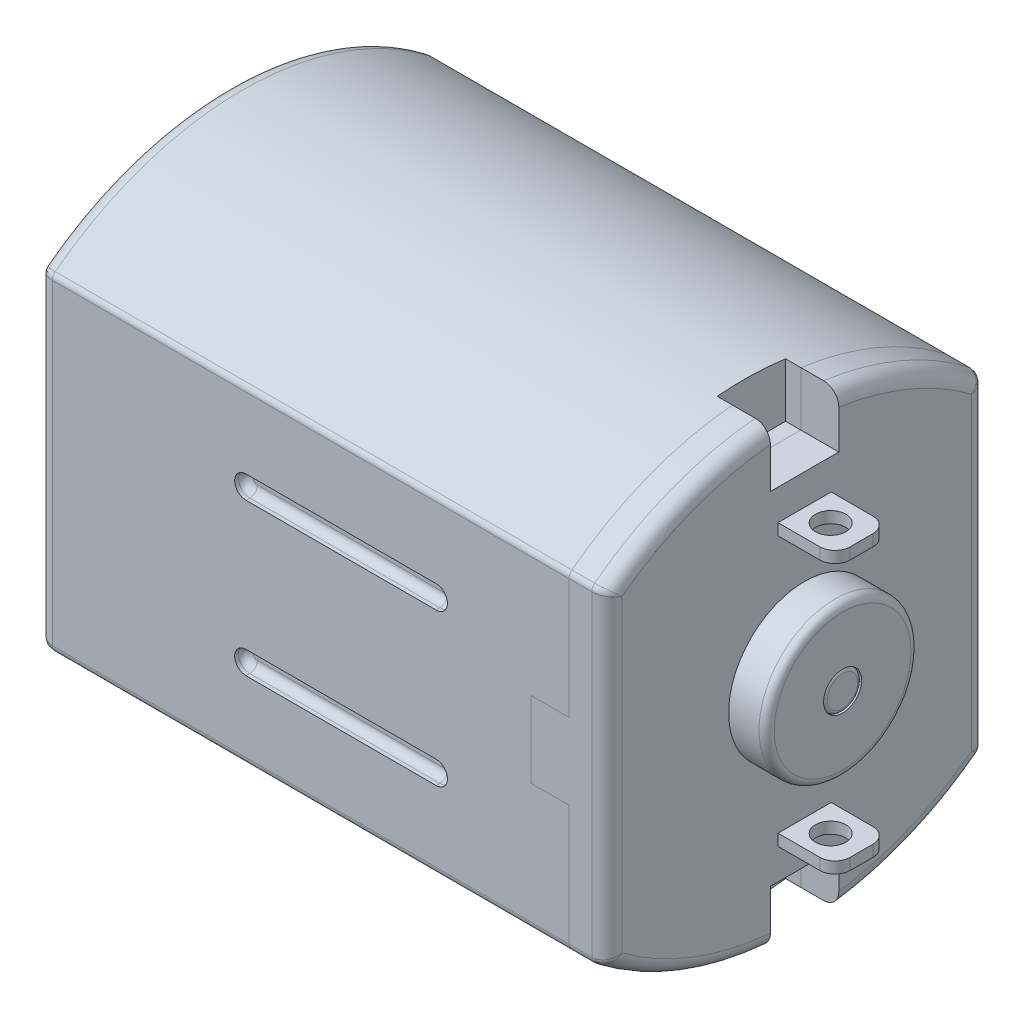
SolidWorks part; units mm, degrees
ref_plane "前视基准面" through (0, 0, 0) normal (0, 0, 1) x (1, 0, 0)
ref_plane "上视基准面" through (0, 0, 0) normal (0, 1, 0) x (1, 0, 0)
ref_plane "右视基准面" through (0, 0, 0) normal (1, 0, 0) x (0, 0, -1)
sketch "草图5" plane through (0, 0, 0) normal (0, 0, 1) x (1, 0, 0)
  line L0 (0, 0) -> (55.3713, 0) construction
  line L1 (0, -6) -> (0, 6)
  line L2 (0, 6) -> (14, 6)
  line L3 (14, 6) -> (14, 1)
  line L4 (14, 1) -> (13, 1)
  line L5 (13, 1) -> (13, -1)
  line L6 (14, -1) -> (13, -1)
  line L7 (14, -6) -> (14, -1)
  line L8 (0, -6) -> (14, -6)
  point P9 (13, 0)
  dimension "D1" = 6
  dimension "D2" = 14
  dimension "D3" = 1
  dimension "D4" = 1
extrude "凸台-拉伸3" add sketch "草图5" along normal blind 10
sketch "草图6" plane through (0, 0, 0) normal (0, 0, 1) x (1, 0, 0)
  line L0 (14, 6) -> (15, 6)
  line L1 (14, 1) -> (14, 6) construction
  line L2 (13, 1) -> (14, 1) construction
  line L3 (13, -1) -> (13, 1) construction
  line L4 (14, -1) -> (13, -1) construction
  line L5 (14, -6) -> (14, -1) construction
  line L6 (14, 1) -> (14, 6)
  line L7 (13, 1) -> (14, 1)
  line L8 (13, -1) -> (13, 1)
  line L9 (14, -1) -> (13, -1)
  line L10 (14, -6) -> (14, -1)
  line L11 (14, -6) -> (15, -6)
  line L12 (15, -6) -> (15, 6)
  dimension "D1" = 1
extrude "凸台-拉伸4" add sketch "草图6" along normal blind 10 separate body
sketch "草图7" plane through (0, 0, 0) normal (-1, 0, 0) x (0, 0, 1)
  line L0 (0, 6) -> (0, -6) construction
  circle A0 centre (5, 0) radius 1
  dimension "D2" = 2
  dimension "D1" = 5
extrude "凸台-拉伸5" add sketch "草图7" along normal blind 3
sketch "草图8" plane through (0, 0, 0) normal (-1, 0, 0) x (0, 0, 1)
  line L0 (10, 6) -> (10, 4.2617)
  line L1 (10, 6) -> (0, 6) construction
  line L2 (0, 0) -> (10, 0) construction
  line L3 (10, -6) -> (0, -6) construction
  line L4 (5, 6) -> (5, 0) construction
  line L5 (10, 6) -> (0, 6)
  line L6 (0, 6) -> (0, -6) construction
  line L7 (10, -6) -> (0, -6)
  line L10 (0, 6) -> (0, 4.2617)
  line L11 (10, 6) -> (10, -6) construction
  line L12 (0, -6) -> (0, -4.2617)
  line L13 (10, -6) -> (10, -4.2617)
  arc A0 (10, 4.2617) -> (0, 4.2617) centre (5, -2.06) ccw
  arc A2 (10, -4.2617) -> (0, -4.2617) centre (5, 2.06) cw
extrude "切除-拉伸2" cut sketch "草图8" against normal up to next
sketch "草图11" plane through (14, 0, 0) normal (-1, 0, 0) x (0, 0, 1)
  line L12 (10, 6) -> (0, 6) construction
  line L15 (0, -1) -> (0, -6) construction
  line L16 (10, -6) -> (0, -6) construction
  line L17 (10, -1) -> (10, -6) construction
  line L18 (10, 6) -> (0, 6)
  line L19 (0, 0) -> (10, 0) construction
  line L20 (10, 4.2617) -> (10, -4.2617) construction
  line L21 (0, -4.2617) -> (0, -6)
  line L22 (10, -6) -> (0, -6)
  line L23 (10, -4.2617) -> (10, -6)
  line L24 (0, 4.2617) -> (0, 6)
  line L25 (10, 4.2617) -> (10, 6)
  arc A5 (0, -4.2617) -> (10, -4.2617) centre (5, 2.06) ccw construction
  arc A6 (0, 4.2617) -> (10, 4.2617) centre (5, -2.06) cw
  arc A7 (0, -4.2617) -> (10, -4.2617) centre (5, 2.06) ccw
extrude "切除-拉伸8" cut sketch "草图11" against normal blind 3
fillet "圆角6" radius 0.4 4 edges at (15, 0, 0) (15, -6, 5) (15, 0, 10) (15, 6, 5)
fillet "圆角3" radius 0.2 4 edges at (7, -4.2617, 0) (7, -4.2617, 10) (7, 4.2617, 10) (7, 4.2617, 0)
fillet "圆角4" radius 0.2 8 edges at (14.3, -4.2617, 0) (14.3, 4.2617, 0) (14.3, -4.2617, 10) (14.3, 4.2617, 10) (14.8311, -4.226, 0.0735) (14.8311, 4.226, 0.0735) (14.8311, -4.226, 9.9265) (14.8311, 4.226, 9.9265)
sketch "草图12" plane through (0, 0, 10) normal (0, 0, 1) x (1, 0, 0)
  line L0 (0, 0) -> (15, 0) construction
  line L1 (0, 1) -> (0, -1) construction
  line L2 (15, -4.1641) -> (15, 4.1641) construction
  line L3 (5.5, 2) -> (10.5, 2) construction
  line L4 (5.5, 2.3) -> (10.5, 2.3)
  line L5 (5.5, 1.7) -> (10.5, 1.7)
  line L6 (0, 4.1641) -> (0, -4.1641) construction
  line L7 (5.5, -2) -> (10.5, -2) construction
  line L8 (5.5, -2.3) -> (10.5, -2.3)
  line L9 (5.5, -1.7) -> (10.5, -1.7)
  arc A0 (5.5, 2.3) -> (5.5, 1.7) centre (5.5, 2) ccw
  arc A1 (10.5, 1.7) -> (10.5, 2.3) centre (10.5, 2) ccw
  arc A2 (5.5, -2.3) -> (5.5, -1.7) centre (5.5, -2) cw
  arc A3 (10.5, -1.7) -> (10.5, -2.3) centre (10.5, -2) cw
  point P8 (8, 2)
  point P17 (8, -2)
  dimension "D2" = 0.3
  dimension "D1" = 2
  dimension "D3" = 5
  dimension "D4" = 8
extrude "切除-拉伸9" cut sketch "草图12" against normal blind 0.3
fillet "圆角5" radius 0.2 8 edges at (8, -1.7, 9.7) (10.8, -2, 9.7) (8, -2.3, 9.7) (5.2, -2, 9.7) (8, 2.3, 9.7) (10.8, 2, 9.7) (8, 1.7, 9.7) (5.2, 2, 9.7)
ref_plane "基准面2" through (0, 0, 5) normal (0, 0, 1) x (1, 0, 0)
mirror "镜向1" about plane through (0, 0, 5) normal (0, 0, 1) of "圆角5", "切除-拉伸9"
sketch "草图13" plane through (15, 0, 0) normal (1, 0, 0) x (0, 0, -1)
  circle A0 centre (-4.7989, 0) radius 2
  circle A1 centre (-4.7989, 0) radius 0.5
extrude "凸台-拉伸6" add sketch "草图13" along normal blind 1 separate body
sketch "草图14" plane through (15, 0, 0) normal (1, 0, 0) x (0, 0, -1)
  circle A0 centre (-4.7989, 0) radius 0.5 construction
  circle A2 centre (-4.7989, 0) radius 0.5
extrude "凸台-拉伸7" add sketch "草图14" along normal blind 1
fillet "圆角7" radius 0.4 8 edges at (0, 0, 0) (0, -4.2524, 0.0205) (0, -6, 5) (0, -4.2524, 9.9795) (0, 0, 10) (0, 4.2524, 9.9795) (0, 6, 5) (0, 4.2524, 0.0205)
sketch "草图15" plane through (15, 0, 0) normal (1, 0, 0) x (0, 0, -1)
  line L0 (-10.1041, 0) -> (0, 0) construction
  line L1 (-4.7989, -5.5974) -> (-4.7989, 5.5974) construction
  line L2 (-4.0989, 3.6889) -> (-5.4989, 3.6889)
  line L3 (-5.4989, 3.6889) -> (-5.4989, 3.3889)
  line L4 (-5.4989, 3.3889) -> (-4.0989, 3.3889)
  line L5 (-4.0989, 3.6889) -> (-4.0989, 3.3889)
  line L6 (-4.0989, -3.6889) -> (-4.0989, -3.3889)
  line L7 (-5.4989, -3.3889) -> (-4.0989, -3.3889)
  line L8 (-5.4989, -3.6889) -> (-5.4989, -3.3889)
  line L9 (-4.0989, -3.6889) -> (-5.4989, -3.6889)
  arc A0 (-0.4, 4.065) -> (-9.6, 4.065) centre (-5, -2.06) ccw construction
  point P14 (-4.7989, 3.3889)
  point P15 (-4.7989, 3.6889)
  point P20 (-4.7989, -3.6889)
  point P21 (-4.7989, -3.3889)
  dimension "D1" = 0.7
  dimension "D2" = 0.3
extrude "凸台-拉伸8" add sketch "草图15" along normal blind 1.5
sketch "草图16" plane through (0, 3.6889, 0) normal (0, 1, 0) x (1, 0, 0)
  line L1 (16.5, -4.7989) -> (15, -4.7989) construction
  line L2 (16.5, -4.0989) -> (16.5, -5.4989) construction
  line L3 (15, -4.0989) -> (15, -5.4989) construction
  circle A0 centre (15.7, -4.8127) radius 0.4
  dimension "D1" = 0.8
  dimension "D2" = 0.8
extrude "切除-拉伸10" cut sketch "草图16" against normal up to next
mirror "镜向2" about plane through (0, 0, 0) normal (0, 1, 0) of "切除-拉伸10"
fillet "圆角8" radius 0.4 4 edges at (16.5, -3.5389, 5.4989) (16.5, -3.5389, 4.0989) (16.5, 3.5389, 5.4989) (16.5, 3.5389, 4.0989)
sketch "草图17" plane through (15, 0, 0) normal (1, 0, 0) x (0, 0, -1)
  line L0 (-4.7989, -7.5115) -> (-4.7989, 7.5115) construction
  line L1 (-3.8989, 4.5) -> (-5.6989, 4.5)
  line L2 (-5.6989, 4.5) -> (-5.6989, 6.5)
  line L3 (-5.6989, 6.5) -> (-3.8989, 6.5)
  line L4 (-3.8989, 4.5) -> (-3.8989, 6.5)
  line L5 (-9.7686, 0) -> (-1.1767, 0) construction
  line L6 (-3.8989, -4.5) -> (-3.8989, -6.5)
  line L7 (-5.6989, -6.5) -> (-3.8989, -6.5)
  line L8 (-5.6989, -4.5) -> (-5.6989, -6.5)
  line L9 (-3.8989, -4.5) -> (-5.6989, -4.5)
  point P8 (-4.7989, 6.5)
  point P9 (-4.7989, 4.5)
  point P17 (-4.7989, -4.5)
  point P18 (-4.7989, -6.5)
  dimension "D2" = 2
  dimension "D3" = 0.9
extrude "切除-拉伸11" cut sketch "草图17" against normal blind 1.4
fillet "圆角9" radius 0.2 1 edges at (16, 0, 2.7989)
fillet "圆角10" radius 0.1 1 edges at (16, 0, 4.2989)
